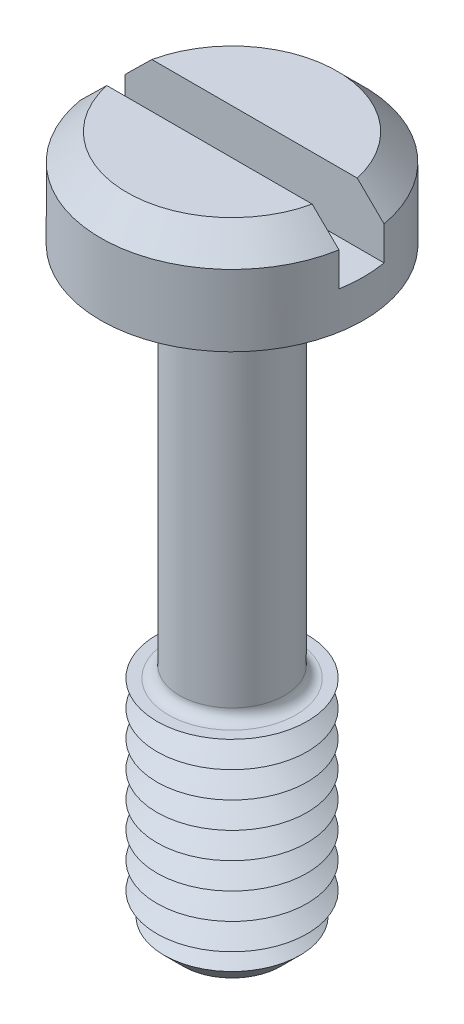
SolidWorks part; units mm, degrees
ref_plane "Front Plane" through (0, 0, 0) normal (0, 0, 1) x (1, 0, 0)
ref_plane "Top Plane" through (0, 0, 0) normal (0, 1, 0) x (1, 0, 0)
ref_plane "Right Plane" through (0, 0, 0) normal (1, 0, 0) x (0, 0, -1)
sketch "Sketch1" plane through (0, 0, 0) normal (0, 1, 0) x (1, 0, 0)
  circle A0 centre (0, 0) radius 3.5
  dimension "D1" = 7
extrude "Boss-Extrude1" add sketch "Sketch1" along normal blind 2.6
sketch "Sketch2" plane through (0, 0, 0) normal (0, -1, 0) x (1, 0, 0)
  circle A0 centre (0, 0) radius 1.4
  dimension "D1" = 2.8
extrude "Boss-Extrude2" add sketch "Sketch2" along normal blind 16
sketch "Sketch3" plane through (0, -16, 0) normal (0, -1, 0) x (1, 0, 0)
  circle A0 centre (0, 0) radius 2
  dimension "D1" = 4
extrude "Boss-Extrude3" add sketch "Sketch3" against normal blind 6
chamfer "Chamfer1" distance 0.7 angle 45 1 edges at (0, -16, -2)
sketch "Sketch4" plane through (0, 0, 0) normal (1, 0, 0) x (0, 0, -1)
  line L0 (0, -6.5871) -> (0, -12.0372) construction
sketch "Sketch5" plane through (0, 0, 0) normal (1, 0, 0) x (0, 0, -1)
  line L0 (-2, -10) -> (-1.3938, -10.35)
  line L1 (-1.3938, -10.35) -> (-2, -10.7)
  line L2 (-2, -10) -> (-2, -15.3) construction
  line L3 (-2, -10.7) -> (-2, -10)
  dimension "D1" = 0.7
revolve "Cut-Revolve1" cut sketch "Sketch5" angle 360 about L0
pattern_linear "LPattern1" count 8 spacing 0.7 along (0, -1, 0) of "Cut-Revolve1"
fillet "Fillet1" radius 0.3 2 edges at (0, -10, -1.4) (0, 0, -1.4)
chamfer "Chamfer2" distance 0.7 angle 45 1 edges at (0, 2.6, 3.5)
sketch "Sketch6" plane through (0, 2.6, 0) normal (0, 1, 0) x (1, 0, 0)
  line L1 (3.5, -0.6) -> (-3.5, -0.6)
  line L2 (3.5, -0.6) -> (3.5, 0.6)
  line L3 (3.5, 0.6) -> (-3.5, 0.6)
  line L4 (-3.5, -0.6) -> (-3.5, 0.6)
  line L5 (3.5, -0.6) -> (-3.5, 0.6) construction
  line L6 (3.5, 0.6) -> (-3.5, -0.6) construction
  circle A0 centre (0, 0) radius 3.5 construction
  point P0 (0, 0)
  dimension "D1" = 1.2
extrude "Cut-Extrude1" cut sketch "Sketch6" against normal blind 1.6
